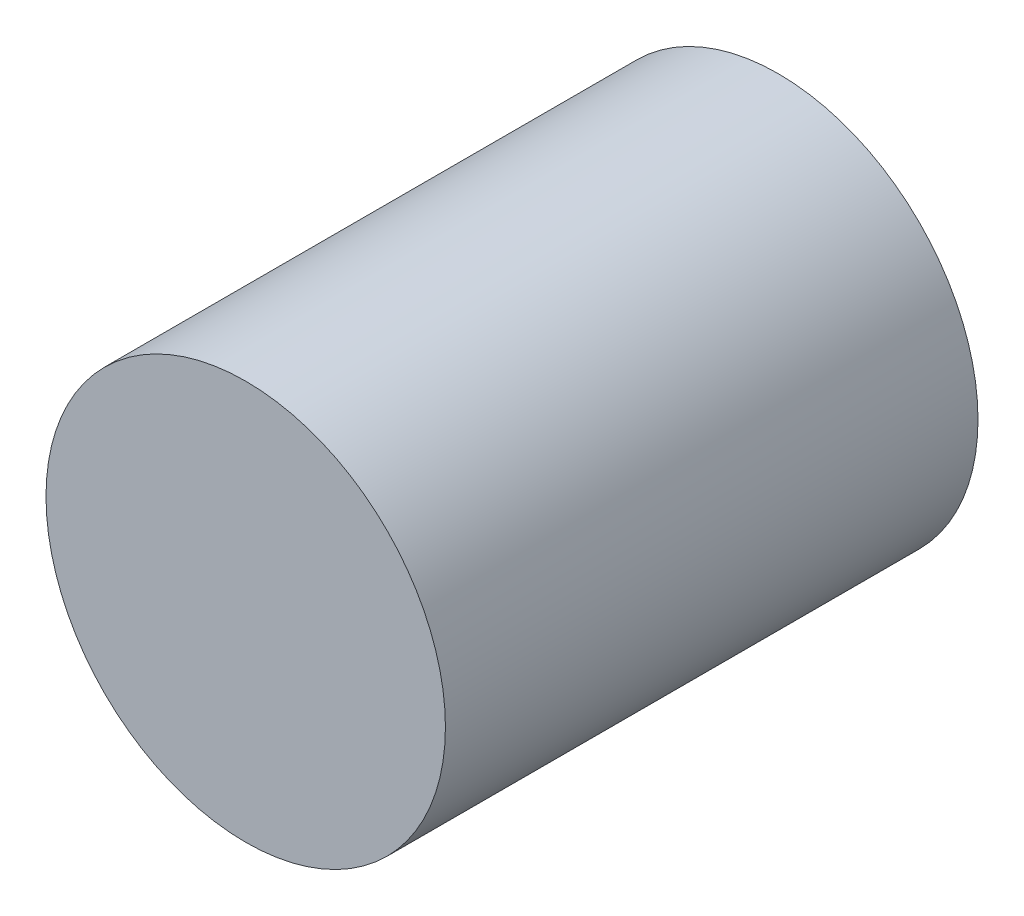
SolidWorks part; units mm, degrees
ref_plane "Přední rovina" through (0, 0, 0) normal (0, 0, 1) x (1, 0, 0)
ref_plane "Horní rovina" through (0, 0, 0) normal (0, 1, 0) x (1, 0, 0)
ref_plane "Pravá rovina" through (0, 0, 0) normal (1, 0, 0) x (0, 0, -1)
sketch "Skica1" plane through (0, 0, 0) normal (0, 0, 1) x (1, 0, 0)
  circle A0 centre (0, 0) radius 25
  dimension "D1" = 50
extrude "Přidat vysunutím2" add sketch "Skica1" along normal blind 23.5
sketch "Skica7" plane through (0, 0, 23.5) normal (0, 0, 1) x (1, 0, 0)
  circle A0 centre (0, 0) radius 25
  dimension "D1" = 50
extrude "Přidat vysunutím3" add sketch "Skica7" along normal blind 15
sketch "Skica8" plane through (0, 0, 38.5) normal (0, 0, 1) x (1, 0, 0)
  circle A0 centre (0, 0) radius 15
  dimension "D1" = 30
extrude "Přidat vysunutím4" add sketch "Skica8" along normal blind 40
sketch "Skica9" plane through (0, 0, 0) normal (0, 1, 0) x (1, 0, 0)
  line L0 (0, 0) -> (0, -15)
  line L1 (25, 0) -> (-25, 0) construction
  line L2 (0, 0) -> (20, 0)
  line L3 (0, -15) -> (20, 0)
  line L4 (0, -53.9245) -> (0, 1.9891) construction
  dimension "D1" = 15
  dimension "D2" = 20
revolve "Odebrat rotací1" cut sketch "Skica9" angle 360 about L4
scale "Měřítko1" scale about origin uniform scaling yes scale factor 0.655
sketch "Skica10" plane through (0, 0, 0) normal (0, 0, -1) x (-1, 0, 0)
  line L0 (0, 0) -> (0, 30.2592)
  line L1 (0, 0) -> (26.9611, -13.7374)
  circle A0 centre (0, 0) radius 30.2592
  dimension "D2" = 60.5184
  dimension "D1" = 117
extrude "Odebrat vysunutím1" cut sketch "Skica10" against normal blind 15 contours L0 L1 M3 | L1 L0 M3 M4 | L1 A0 L0 M4
sketch "Skica11" plane through (0, 0, 25.2175) normal (0, 0, 1) x (1, 0, 0)
  circle A0 centre (0, 0) radius 75.9743
extrude "Odebrat vysunutím2" cut sketch "Skica11" against normal through all
